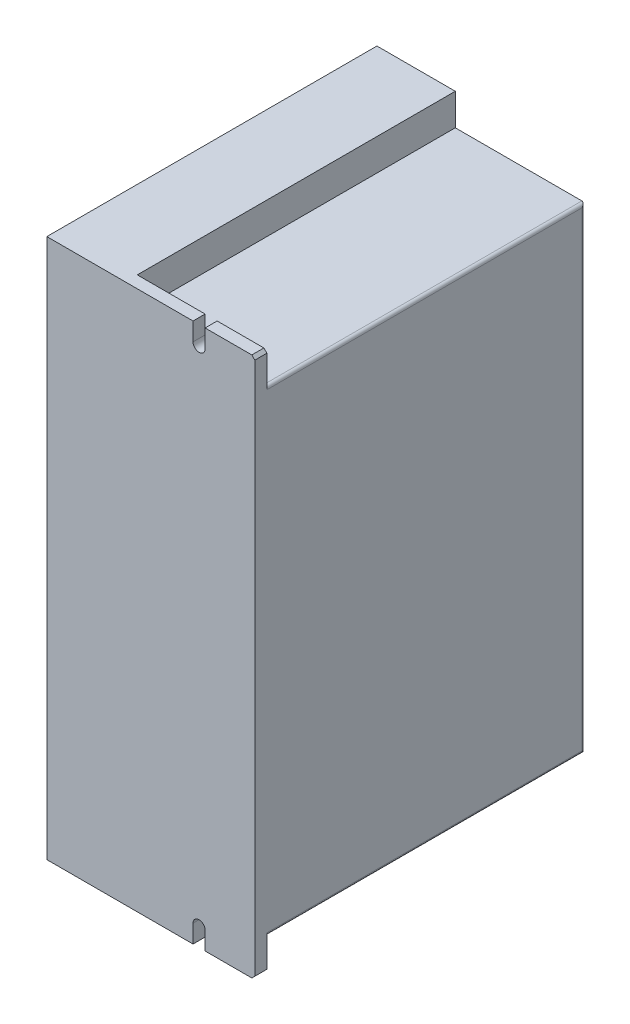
SolidWorks part; units mm, degrees
ref_plane "前视基准面" through (0, 0, 0) normal (0, 0, 1) x (1, 0, 0)
ref_plane "上视基准面" through (0, 0, 0) normal (0, 1, 0) x (1, 0, 0)
ref_plane "右视基准面" through (0, 0, 0) normal (1, 0, 0) x (0, 0, -1)
sketch "草图1" plane through (0, 0, 0) normal (1, 0, 0) x (0, 0, -1)
  line L1 (-54.75, -89.5) -> (54.75, -89.5)
  line L2 (-54.75, -89.5) -> (-54.75, 89.5)
  line L3 (-54.75, 89.5) -> (54.75, 89.5)
  line L4 (54.75, -89.5) -> (54.75, 89.5)
  line L5 (-54.75, -89.5) -> (54.75, 89.5) construction
  line L6 (-54.75, 89.5) -> (54.75, -89.5) construction
  point P0 (0, 0)
extrude "凸台-拉伸1" add sketch "草图1" along normal blind 69
sketch "草图2" plane through (69, 0, 0) normal (1, 0, 0) x (0, 0, -1)
  line L1 (54.75, 89.5) -> (-54.75, 89.5) construction
  line L2 (-50.75, 89.5) -> (-50.75, 79)
  line L3 (-50.75, 79) -> (54.75, 79)
  line L4 (54.75, -89.5) -> (54.75, 89.5) construction
  line L5 (54.75, 79) -> (54.75, 89.5)
  line L6 (54.75, 89.5) -> (-50.75, 89.5)
  line L7 (-50.75, -89.5) -> (-50.75, -79)
  line L8 (-54.75, -89.5) -> (54.75, -89.5) construction
  line L9 (-50.75, -79) -> (54.75, -79)
  line L10 (54.75, -79) -> (54.75, -89.5)
  line L11 (54.75, -89.5) -> (-50.75, -89.5)
extrude "切除-拉伸1" cut sketch "草图2" against normal blind 43
sketch "草图3" plane through (0, 0, 54.75) normal (0, 0, 1) x (1, 0, 0)
  line L1 (69, 89.5) -> (0, 89.5) construction
  line L3 (48.5, 83.5) -> (48.5, 89.5)
  line L4 (48.5, 89.5) -> (52.5, 89.5)
  line L5 (52.5, 89.5) -> (52.5, 83.5)
  line L7 (69, -89.5) -> (0, -89.5) construction
  line L8 (48.5, -83.5) -> (48.5, -89.5)
  line L9 (48.5, -89.5) -> (52.5, -89.5)
  line L10 (52.5, -89.5) -> (52.5, -83.5)
  arc A0 (48.5, 83.5) -> (52.5, 83.5) centre (50.5, 83.5) ccw
  arc A1 (52.5, -83.5) -> (48.5, -83.5) centre (50.5, -83.5) ccw
extrude "切除-拉伸2" cut sketch "草图3" against normal blind 4
fillet "圆角1" radius 1 3 edges at (69, -79, -2) (69, 0, -54.75) (69, 79, -2)
chamfer "倒角1" distance 1 angle 45 2 edges at (69, -89.5, 52.75) (69, 89.5, 52.75)
